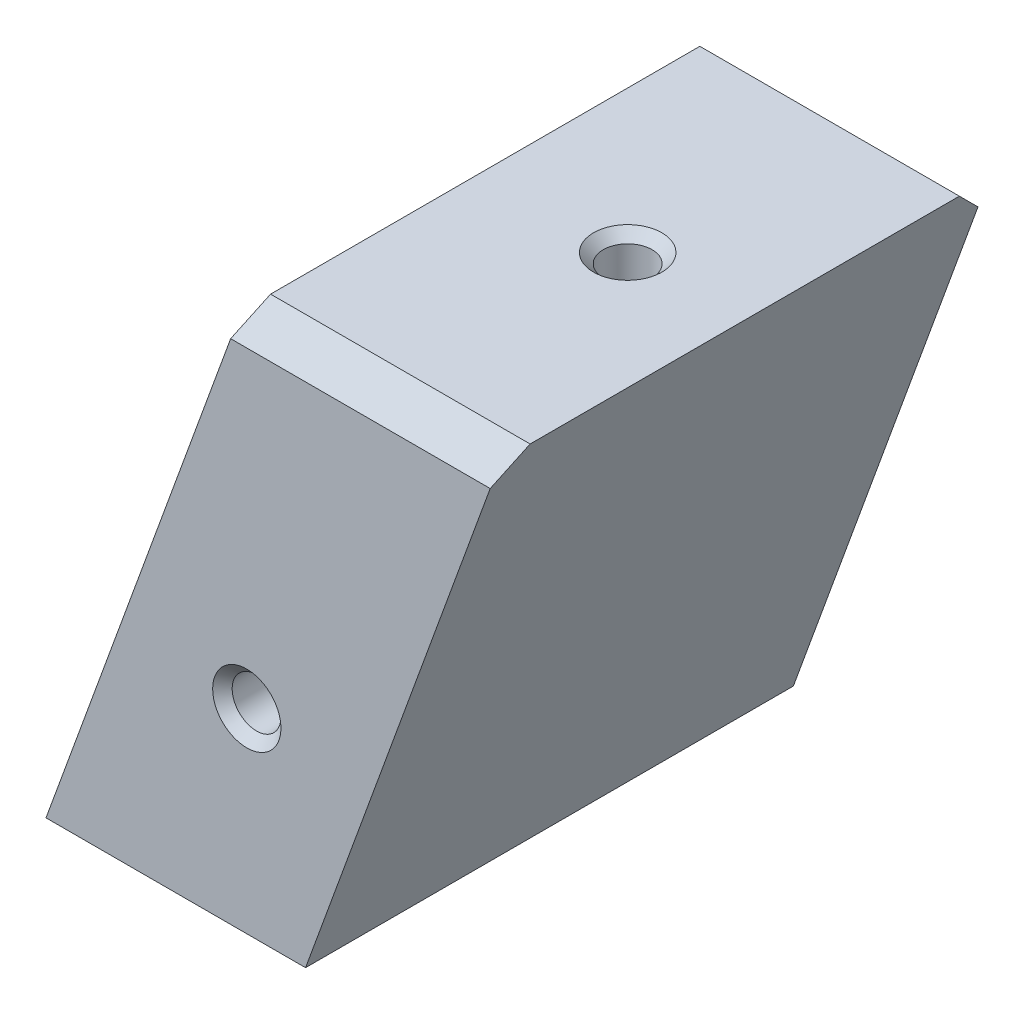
SolidWorks part; units mm, degrees
ref_plane "Plan de face" through (0, 0, 0) normal (0, 0, 1) x (1, 0, 0)
ref_plane "Plan de dessus" through (0, 0, 0) normal (0, 1, 0) x (1, 0, 0)
ref_plane "Plan de droite" through (0, 0, 0) normal (1, 0, 0) x (0, 0, -1)
sketch "Esquisse1" plane through (0, 0, 0) normal (0, 0, 1) x (1, 0, 0)
  line L0 (0, 0) -> (26.6044, 0)
  line L1 (0, 0) -> (20.0184, 55)
  line L2 (20.0184, 55) -> (46.6228, 55)
  line L3 (46.6228, 55) -> (26.6044, 0)
  dimension "D1" = 55
  dimension "D2" = 25
  dimension "D3" = 70
extrude "Extrusion1" add sketch "Esquisse1" along normal mid plane 50
hole_wizard "Diamètre du perçage Ø8.5 (8.5)1" positions "Esquisse3" profile "Esquisse2" hole size "Ø8.5" standard "ISO"
sketch "Esquisse3" plane through (0, 0, 0) normal (0, -1, 0) x (1, 0, 0)
  line L0 (15, -26.0602) -> (15, 27.7722) construction
  line L2 (0, 25) -> (0, -25) construction
  line L3 (0, -25) -> (26.6044, -25) construction
  point P0 (15, 16.4)
  point P12 (15, -13.6)
  dimension "D1" = 15
  dimension "D2" = 30
  dimension "D3" = 11.4
sketch "Esquisse2" plane through (15, 0, 16.4) normal (1, 0, 0) x (0, 0, -1)
  line L0 (0, 0) -> (0, 27.0537)
  line L1 (0, 27.0537) -> (4.25, 24.5)
  line L2 (4.25, 24.5) -> (4.25, 0)
  line L5 (4.25, 0) -> (0, 0)
  line L10 (0, 27.0537) -> (-4.25, 24.5) construction
  line L11 (0, -6.35) -> (0, 107.95) construction
  dimension "Diamètre du perçage" = 8.5
  dimension "Profondeur du perçage" = 24.5
  dimension "Angle de pointe" = 118
chamfer "Chanfrein1" distance 1 angle 45 2 edges at (15, 0, -17.85) (15, 0, 12.15)
ref_plane "Plan1" through (0, 0, 2) normal (0, 0, 1) x (1, 0, 0)
sketch "Esquisse4" plane through (0, 0, 2) normal (0, 0, 1) x (1, 0, 0)
  line L0 (-32.8467, 30) -> (60.3937, 30) construction
  line L1 (0, 0) -> (26.6044, 0) construction
  line L2 (0, 30) -> (0, 21)
  line L3 (28, 21) -> (28, 30)
  line L5 (0, 21) -> (28, 21)
  line L9 (0, 30) -> (28, 30)
  dimension "D1" = 30
  dimension "D2" = 28
  dimension "D4" = 18
revolve "Enlèvement de matière-Révolution1" cut sketch "Esquisse4" angle 360 about L0
chamfer "Chanfrein2" distance 3 angle 45 2 edges at (33.3206, 55, -25) (33.3206, 55, 25)
hole_wizard "Diamètre du perçage Ø5.0 (5)1" positions "Esquisse6" profile "Esquisse5" hole size "Ø5.0" standard "ISO"
sketch "Esquisse6" plane through (0, 0, -25) normal (0, 0, -1) x (-1, 0, 0)
  line L0 (-33.3206, 55) -> (-13.3022, 0) construction
  line L1 (-46.6228, 55) -> (-20.0184, 55) construction
  line L2 (0, 0) -> (-26.6044, 0) construction
  point P0 (-20.5816, 20)
  dimension "D2" = 35
sketch "Esquisse5" plane through (20.5816, 20, -25) normal (1, 0, 0) x (0, 1, 0)
  line L0 (0, 0) -> (0, 16.5022)
  line L1 (0, 16.5022) -> (2.5, 15)
  line L2 (2.5, 15) -> (2.5, 0)
  line L5 (2.5, 0) -> (0, 0)
  line L10 (0, 16.5022) -> (-2.5, 15) construction
  line L11 (0, -6.35) -> (0, 107.95) construction
  dimension "Diamètre du perçage" = 5
  dimension "Profondeur du perçage" = 15
  dimension "Angle de pointe" = 118
chamfer "Chanfrein3" distance 1 angle 45 1 edges at (18.0816, 20, -25)
hole_wizard "Diamètre du perçage Ø5.0 (5)2" positions "Esquisse8" profile "Esquisse7" hole size "Ø5.0" standard "ISO"
sketch "Esquisse8" plane through (0, 0, 25) normal (0, 0, 1) x (1, 0, 0)
  circle A0 centre (20.5816, 20) radius 2.5 construction
  point P0 (20.5816, 20)
sketch "Esquisse7" plane through (20.5816, 20, 25) normal (1, 0, 0) x (0, -1, 0)
  line L0 (0, 0) -> (0, 16.5022)
  line L1 (0, 16.5022) -> (2.5, 15)
  line L2 (2.5, 15) -> (2.5, 0)
  line L5 (2.5, 0) -> (0, 0)
  line L10 (0, 16.5022) -> (-2.5, 15) construction
  line L11 (0, -6.35) -> (0, 107.95) construction
  dimension "Diamètre du perçage" = 5
  dimension "Profondeur du perçage" = 15
  dimension "Angle de pointe" = 118
chamfer "Chanfrein4" distance 1 angle 45 1 edges at (23.0816, 20, 25)
hole_wizard "Diamètre du perçage Ø5.0 (5)3" positions "Esquisse10" profile "Esquisse9" hole size "Ø5.0" standard "ISO"
sketch "Esquisse10" plane through (0, 55, 0) normal (0, 1, 0) x (-1, 0, 0)
  line L0 (-46.6228, 22) -> (-46.6228, -22) construction
  point P0 (-34.6228, 0)
  dimension "D1" = 12
sketch "Esquisse9" plane through (34.6228, 55, 0) normal (1, 0, 0) x (0, 0, 1)
  line L0 (0, 0) -> (0, 16.5022)
  line L1 (0, 16.5022) -> (2.5, 15)
  line L2 (2.5, 15) -> (2.5, 0)
  line L5 (2.5, 0) -> (0, 0)
  line L10 (0, 16.5022) -> (-2.5, 15) construction
  line L11 (0, -6.35) -> (0, 107.95) construction
  dimension "Diamètre du perçage" = 5
  dimension "Profondeur du perçage" = 15
  dimension "Angle de pointe" = 118
chamfer "Chanfrein5" distance 1 angle 45 1 edges at (34.6228, 55, 2.5)
thread "Filetage1" pitch 1.5 start angle 0, offset 3, length 23, pitch 1.5, diameter 8.5
ref_plane "Plan2" through (19.25, -2, 16.4) normal (0, 0, 1) x (1, 0, 0)
sketch "Profil de filetage1" plane through (19.25, -2, 16.4) normal (0, 0, 1) x (1, 0, 0)
  line L0 (0, 0) -> (0, 1.5) construction
  line L1 (0, 0) -> (0.8119, 0.4687)
  line L2 (0.8119, 0.4687) -> (0.8119, 0.6562)
  line L3 (0.8119, 0.6562) -> (0, 1.125)
  line L4 (0.8119, 0.5625) -> (0, 0.5625) construction
  line L11 (0, 0) -> (0, 1.125)
  point P2 (0, 0)
  dimension "Pitch" = 1.5
  dimension "Profile_Angle" = 60
  dimension "Profile_Land" = 0.1875
  dimension "Profile_Height" = 0.8119
thread "Filetage2" pitch 1.5 start angle 0, offset 3, length 23, pitch 1.5, diameter 8.5
ref_plane "Plan3" through (19.25, -2, -13.6) normal (0, 0, 1) x (1, 0, 0)
sketch "Profil de filetage2" plane through (19.25, -2, -13.6) normal (0, 0, 1) x (1, 0, 0)
  line L0 (0, 0) -> (0, 1.5) construction
  line L1 (0, 0) -> (0.8119, 0.4687)
  line L2 (0.8119, 0.4687) -> (0.8119, 0.6562)
  line L3 (0.8119, 0.6562) -> (0, 1.125)
  line L4 (0.8119, 0.5625) -> (0, 0.5625) construction
  line L11 (0, 0) -> (0, 1.125)
  point P2 (0, 0)
  dimension "Pitch" = 1.5
  dimension "Profile_Angle" = 60
  dimension "Profile_Land" = 0.1875
  dimension "Profile_Height" = 0.8119
thread "Filetage3" pitch 1 start angle 0, offset 3, length 13, pitch 1, diameter 5
ref_plane "Plan4" through (18.0816, 20, 27) normal (0, -1, 0) x (-1, 0, 0)
sketch "Profil de filetage3" plane through (18.0816, 20, 27) normal (0, -1, 0) x (-1, 0, 0)
  line L0 (0, 0) -> (0, 1) construction
  line L1 (0, 0) -> (0.5413, 0.3125)
  line L2 (0.5413, 0.3125) -> (0.5413, 0.4375)
  line L3 (0.5413, 0.4375) -> (0, 0.75)
  line L4 (0.5413, 0.375) -> (0, 0.375) construction
  line L11 (0, 0) -> (0, 0.75)
  point P2 (0, 0)
  dimension "Pitch" = 1
  dimension "Profile_Angle" = 60
  dimension "Profile_Land" = 0.125
  dimension "Profile_Height" = 0.5413
thread "Filetage4" pitch 1 start angle 0, offset 3, length 13, pitch 1, diameter 5
ref_plane "Plan5" through (23.0816, 20, -27) normal (0, -1, 0) x (1, 0, 0)
sketch "Profil de filetage4" plane through (23.0816, 20, -27) normal (0, -1, 0) x (1, 0, 0)
  line L0 (0, 0) -> (0, 1) construction
  line L1 (0, 0) -> (0.5413, 0.3125)
  line L2 (0.5413, 0.3125) -> (0.5413, 0.4375)
  line L3 (0.5413, 0.4375) -> (0, 0.75)
  line L4 (0.5413, 0.375) -> (0, 0.375) construction
  line L11 (0, 0) -> (0, 0.75)
  point P2 (0, 0)
  dimension "Pitch" = 1
  dimension "Profile_Angle" = 60
  dimension "Profile_Land" = 0.125
  dimension "Profile_Height" = 0.5413
thread "Filetage5" pitch 1 start angle 0, offset 3, length 13, pitch 1, diameter 5
ref_plane "Plan6" through (32.1228, 57, 0) normal (0, 0, 1) x (-1, 0, 0)
sketch "Profil de filetage5" plane through (32.1228, 57, 0) normal (0, 0, 1) x (-1, 0, 0)
  line L0 (0, 0) -> (0, 1) construction
  line L1 (0, 0) -> (0.5413, 0.3125)
  line L2 (0.5413, 0.3125) -> (0.5413, 0.4375)
  line L3 (0.5413, 0.4375) -> (0, 0.75)
  line L4 (0.5413, 0.375) -> (0, 0.375) construction
  line L11 (0, 0) -> (0, 0.75)
  point P2 (0, 0)
  dimension "Pitch" = 1
  dimension "Profile_Angle" = 60
  dimension "Profile_Land" = 0.125
  dimension "Profile_Height" = 0.5413
